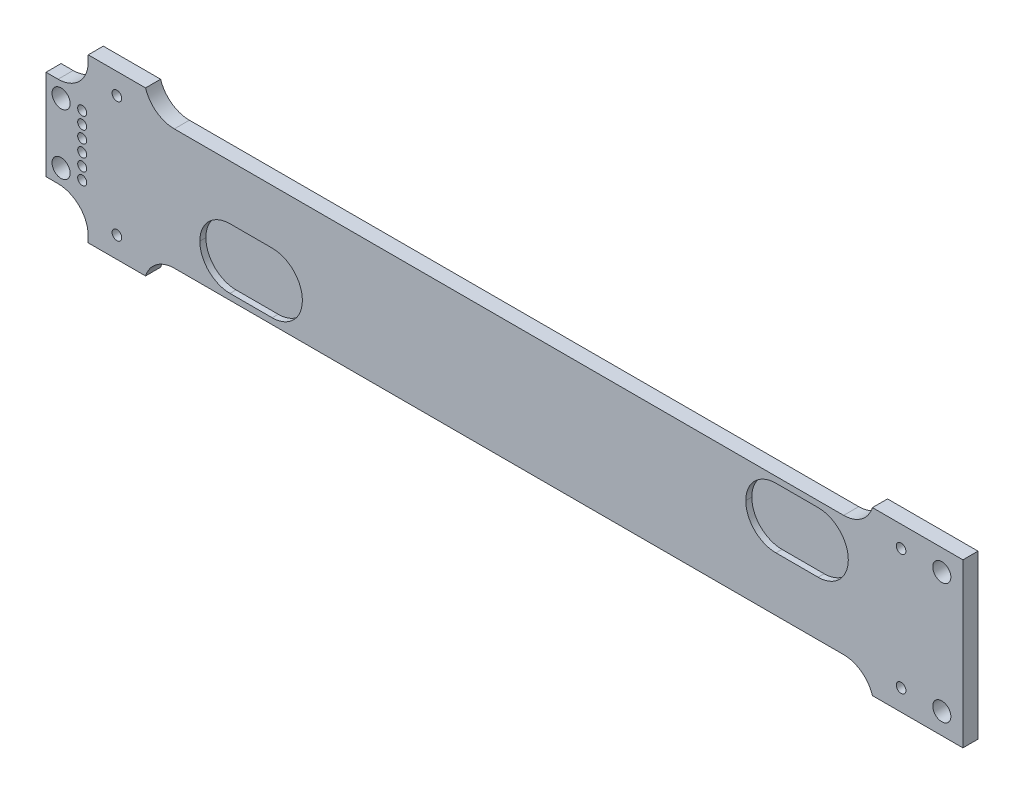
SolidWorks part; units mm, degrees
ref_plane "Спереди" through (0, 0, 0) normal (0, 0, 1) x (1, 0, 0)
ref_plane "Сверху" through (0, 0, 0) normal (0, 1, 0) x (1, 0, 0)
ref_plane "Справа" through (0, 0, 0) normal (1, 0, 0) x (0, 0, -1)
sketch "Эскиз1" plane through (0, 0, 0) normal (0, 0, 1) x (1, 0, 0)
  line L1 (-19.7697, -10) -> (-130.7303, -10)
  line L2 (0, -13.5) -> (0, 13.5) construction
  line L3 (0, 13.5) -> (-15, 13.5)
  line L4 (-130.7303, 10) -> (-19.7697, 10)
  line L6 (-150, 13.5) -> (-150, -13.5)
  line L7 (0, -13.5) -> (-15, -13.5)
  line L8 (-150, -13.5) -> (-135.5, -13.5)
  line L9 (-135.5, 13.5) -> (-150, 13.5)
  line L10 (-150, 13.5) -> (-150, -13.5) construction
  line L11 (0, 13.5) -> (0, -13.5)
  line L12 (0, 0) -> (-143.9085, 0) construction
  arc A0 (-130.7303, 10) -> (-135.5, 13.5) centre (-130.7303, 15) cw
  arc A1 (-19.7697, 10) -> (-15, 13.5) centre (-19.7697, 15) ccw
  arc A2 (-130.7303, -10) -> (-135.5, -13.5) centre (-130.7303, -15) ccw
  arc A3 (-15, -13.5) -> (-19.7697, -10) centre (-19.7697, -15) ccw
  dimension "D6" = 5
  dimension "D1" = 20
  dimension "D2" = 150
  dimension "D3" = 15
  dimension "D4" = 14.5
  dimension "D7" = 27
sheet metal parameters "Листовой металл1" thickness 2.5 parameters "D1"=0.7366
base flange "Базовая кромка1" sketch "Эскиз1" thickness 2.5 reverse thickness direction no parameters "D1"=0.7366
sketch "Эскиз14" plane through (0, 0, -2.5) normal (0, 0, -1) x (-1, 0, 0)
  line L0 (0, 0) -> (-4.6189, 0) construction
  line L1 (17.2321, 8) -> (145.7679, 8)
  line L2 (148.5, -8) -> (148.5, 8) construction
  line L3 (17.2321, -8) -> (145.7679, -8)
  line L4 (148.5, 8) -> (14.5, 8) construction
  line L5 (0, -13.5) -> (0, 13.5) construction
  line L6 (14.5, 5.2679) -> (14.5, -5.2679)
  line L7 (148.5, 5.2679) -> (148.5, -5.2679)
  line L9 (14.5, -8) -> (148.5, -8) construction
  line L10 (14.5, 8) -> (14.5, -8) construction
  line L11 (23.5, 0) -> (192.5911, 0) construction
  arc A0 (17.2321, 8) -> (14.5, 5.2679) centre (15.5, 7) ccw
  arc A1 (14.5, -5.2679) -> (17.2321, -8) centre (15.5, -7) ccw
  arc A2 (145.7679, -8) -> (148.5, -5.2679) centre (147.5, -7) ccw
  arc A3 (148.5, 5.2679) -> (145.7679, 8) centre (147.5, 7) ccw
  dimension "D2" = 1
  dimension "D1" = 4
  dimension "D3" = 1
  dimension "D4" = 1
sketch "Эскиз18" plane through (-150, 0, 0) normal (-1, 0, 0) x (0, 0, 1)
  line L1 (-2.5, 13.5) -> (0, 13.5)
  line L2 (-2.5, 13.5) -> (-2.5, -13.5)
  line L3 (-2.5, -13.5) -> (0, -13.5)
  line L4 (0, 13.5) -> (0, -13.5)
extrude "Бобышка-Вытянуть1" add sketch "Эскиз18" along normal blind 2
sketch "Эскиз19" plane through (0, 0, -2.5) normal (0, 0, -1) x (-1, 0, 0)
  line L0 (152, 0) -> (0, 0) construction
  line L1 (152, 13.5) -> (152, -13.5) construction
  line L2 (0, -13.5) -> (0, 13.5) construction
  line L4 (143, -8) -> (9, -8)
  line L5 (143, -8) -> (143, 8)
  line L6 (143, 8) -> (9, 8)
  line L7 (9, -8) -> (9, 8)
  line L8 (143, -8) -> (9, 8) construction
  line L9 (143, 8) -> (9, -8) construction
  point P6 (76, 0)
  dimension "D1" = 134
  dimension "D2" = 16
extrude "Вырез-Вытянуть1" cut sketch "Эскиз19" against normal blind 1
sketch "Эскиз21" plane through (-9, 0, 0) normal (-1, 0, 0) x (0, 0, 1)
  line L0 (-1.5, 0) -> (-2.5, 0) construction
  line L1 (-1.5, 8) -> (-1.5, -8) construction
  line L2 (-2.5, 8) -> (-2.5, -8) construction
  line L4 (-2.5, -2.5) -> (-1.5, -2.5)
  line L5 (-2.5, -2.5) -> (-2.5, 2.5)
  line L6 (-2.5, 2.5) -> (-1.5, 2.5)
  line L7 (-1.5, -2.5) -> (-1.5, 2.5)
  line L8 (-2.5, -2.5) -> (-1.5, 2.5) construction
  line L9 (-2.5, 2.5) -> (-1.5, -2.5) construction
  point P6 (-2, 0)
  dimension "D1" = 5
extrude "Вырез-Вытянуть7" cut sketch "Эскиз21" against normal through all
sketch "Эскиз22" plane through (0, 0, -2.5) normal (0, 0, -1) x (-1, 0, 0)
  line L0 (76, -8) -> (76, 8) construction
  line L1 (9, -8) -> (143, -8) construction
  line L2 (143, 8) -> (9, 8) construction
  line L3 (142, -6.5) -> (10, 6.5) construction
  circle A0 centre (10, 6.5) radius 2
  circle A1 centre (10, -6.5) radius 2
  circle A2 centre (142, 6.5) radius 2
  circle A3 centre (142, -6.5) radius 2
  point P12 (76, 0)
  point P13 (76, 0)
  dimension "D1" = 4
  dimension "D2" = 132
  dimension "D3" = 4
  dimension "D4" = 13
  dimension "D5" = 13
  dimension "D6" = 132
extrude "Вырез-Вытянуть8" cut sketch "Эскиз22" against normal blind 1
sketch "Эскиз23" plane through (0, 0, 0) normal (0, 0, 1) x (1, 0, 0)
  line L0 (0, -13.5) -> (0, 13.5) construction
  line L1 (-19.7697, 10) -> (-130.7303, 10) construction
  line L2 (-3.5, 0) -> (-7.9257, 0) construction
  line L3 (-3.5, 5) -> (-149.5, 5) construction
  line L4 (-3.5, 5) -> (-3.5, -5) construction
  line L5 (-3.5, -5) -> (-149.5, -5) construction
  line L6 (-149.5, 5) -> (-149.5, -5) construction
  line L7 (-3.5, 5) -> (-149.5, -5) construction
  line L8 (-3.5, -5) -> (-149.5, 5) construction
  line L9 (-3.5, 0) -> (-3.5, 10) construction
  circle A0 centre (-149.5, -5) radius 1.5
  circle A1 centre (-149.5, 5) radius 1.5
  circle A2 centre (-3.5, 10) radius 1.5
  circle A3 centre (-3.5, -10) radius 1.5
  point P5 (-76.5, 0)
  dimension "D3" = 3
  dimension "D4" = 3
  dimension "D5" = 10
  dimension "D6" = 3
  dimension "D1" = 146
  dimension "D2" = 10
  dimension "D7" = 3.5
  dimension "D8" = 5
extrude "Вырез-Вытянуть9" cut sketch "Эскиз23" against normal through all
sketch "Эскиз24" plane through (0, -13.5, 0) normal (0, -1, 0) x (-1, 0, 0)
  line L0 (152, 2.5) -> (135.5, 2.5) construction
  line L1 (152, 0) -> (139, 0)
  line L2 (152, 0) -> (152, 2.5)
  line L3 (152, 2.5) -> (139, 2.5)
  line L4 (139, 0) -> (139, 2.5)
  dimension "D1" = 13
sketch "Эскиз30" plane through (0, 0, -2.5) normal (0, 0, -1) x (-1, 0, 0)
  line L0 (152, 0) -> (146.7263, 0) construction
  line L1 (152, -13.5) -> (146, -13.5)
  line L2 (152, -13.5) -> (152, -7.5)
  line L3 (152, -7.5) -> (146, -7.5)
  line L4 (146, -13.5) -> (146, -7.5)
  line L5 (152, 13.5) -> (152, -13.5) construction
  line L6 (152, 13.5) -> (152, 7.5)
  line L7 (152, 13.5) -> (146, 13.5)
  line L8 (146, 13.5) -> (146, 7.5)
  line L9 (152, 7.5) -> (146, 7.5)
  dimension "D1" = 6
  dimension "D2" = 6
extrude "Вырез-Вытянуть18" cut sketch "Эскиз30" against normal blind 134
fillet "Скругление2" radius 5 2 edges at (-146, 7.5, -1.25) (-146, -7.5, -1.25)
sketch "Эскиз31" plane through (0, 0, -2.5) normal (0, 0, -1) x (-1, 0, 0)
  line L0 (149.5, -3.5) -> (149.5, 3.5) construction
  line L3 (146, 0) -> (146, -5) construction
  circle A0 centre (149.5, -5) radius 1.5 construction
  circle A1 centre (149.5, 5) radius 1.5 construction
  circle A2 centre (146, -5) radius 0.75
  circle A3 centre (146, -3) radius 0.75
  circle A4 centre (146, -1) radius 0.75
  circle A5 centre (146, 1) radius 0.75
  circle A6 centre (146, 3) radius 0.75
  circle A7 centre (146, 5) radius 0.75
  dimension "D2" = 1.5
  dimension "D1" = 5
  dimension "D4" = 3.5
  dimension "D3" = 6
extrude "Вырез-Вытянуть19" cut sketch "Эскиз31" against normal blind 134
sketch "Эскиз32" plane through (0, 0, -2.5) normal (0, 0, -1) x (-1, 0, 0)
  line L0 (146, 13.5) -> (145, 13.5)
  line L1 (135.5, 13.5) -> (146, 13.5) construction
  line L2 (151, 7.5) -> (150, 7.5)
  line L3 (145, 12.5) -> (145, 13.5)
  line L4 (146, 13.5) -> (146, 12.5)
  line L6 (152, 0) -> (148.6345, 0) construction
  line L7 (152, 7.5) -> (152, -7.5) construction
  line L8 (151, -7.5) -> (150, -7.5)
  line L9 (146, -12.5) -> (146, -13.5)
  line L10 (146, -13.5) -> (145, -13.5)
  line L11 (145, -12.5) -> (145, -13.5)
  arc A0 (150, 7.5) -> (145, 12.5) centre (150, 12.5) cw
  arc A1 (146, 12.5) -> (151, 7.5) centre (151, 12.5) ccw
  arc A2 (146, -12.5) -> (151, -7.5) centre (151, -12.5) cw
  arc A3 (150, -7.5) -> (145, -12.5) centre (150, -12.5) ccw
  dimension "D2" = 5
  dimension "D1" = 1
extrude "Вырез-Вытянуть20" cut sketch "Эскиз32" against normal blind 134
sketch "Эскиз33" plane through (0, 0, 0) normal (0, 0, 1) x (1, 0, 0)
  line L0 (-145, -13.5) -> (-135.5, -13.5) construction
  line L2 (0, 13.5) -> (-15, 13.5) construction
  line L3 (-126.5, -9) -> (-109.5, -9)
  line L4 (-126.5, -9) -> (-126.5, 1)
  line L5 (-126.5, 1) -> (-109.5, 1)
  line L6 (-109.5, -9) -> (-109.5, 1)
  line L7 (-126.5, -9) -> (-109.5, 1) construction
  line L8 (-126.5, 1) -> (-109.5, -9) construction
  line L10 (-36, -1) -> (-19, -1)
  line L11 (-36, -1) -> (-36, 9)
  line L12 (-36, 9) -> (-19, 9)
  line L13 (-19, -1) -> (-19, 9)
  line L14 (-36, -1) -> (-19, 9) construction
  line L15 (-36, 9) -> (-19, -1) construction
  circle A0 centre (-149.5, -5) radius 1.5 construction
  dimension "D1" = 4.5
  dimension "D2" = 17
  dimension "D3" = 10
  dimension "D4" = 4.5
  dimension "D5" = 17
  dimension "D6" = 23
extrude "Вырез-Вытянуть21" cut sketch "Эскиз33" against normal blind 1
fillet "Скругление3" radius 5 8 edges at (-36, -1, -0.5) (-19, -1, -0.5) (-36, 9, -0.5) (-19, 9, -0.5) (-126.5, -9, -0.5) (-126.5, 1, -0.5) (-109.5, -9, -0.5) (-109.5, 1, -0.5)
sketch "Эскиз34" plane through (0, 0, 0) normal (0, 0, 1) x (1, 0, 0)
  line L0 (-3.5, 10) -> (-10.25, 10) construction
  line L1 (-3.5, -10) -> (-10.25, -10) construction
  circle A0 centre (-10.25, 10) radius 0.6927
  circle A1 centre (-10.25, -10) radius 0.7613
  dimension "D1" = 6.75
  dimension "D2" = 6.75
extrude "Вырез-Вытянуть22" cut sketch "Эскиз34" against normal blind 10
hole_wizard "Отверстие обработанное метчиком M21" positions "Эскиз35" profile "Эскиз36" tap size "M2" standard "ISO"
sketch "Эскиз35" plane through (0, 0, 0) normal (0, 0, 1) x (1, 0, 0)
  point P0 (-10.25, 10)
  point P3 (-10.25, -10)
sketch "Эскиз36" plane through (-10.25, 10, 0) normal (1, 0, 0) x (0, -1, 0)
  line L0 (0, 0) -> (0, 2.5)
  line L1 (0, 2.5) -> (0.8, 2.5)
  line L2 (0.8, 2.5) -> (0.8, 0)
  line L5 (0.8, 0) -> (0, 0)
  line L11 (0, -6.35) -> (0, 107.95) construction
  dimension "Диаметр проходного сверла" = 1.6
  dimension "Глубина проходного сверла" = 2.5
sketch "Эскиз37" plane through (0, 0, -1.5) normal (0, 0, -1) x (-1, 0, 0)
  line L0 (11.3229, -8) -> (9, -8) construction
  line L1 (9, -4.7679) -> (9, -8) construction
sketch "Эскиз38" plane through (0, 0, -1.5) normal (0, 0, -1) x (-1, 0, 0)
  line L1 (9, -2.5) -> (0, -2.5)
  line L2 (9, -2.5) -> (9, 2.5)
  line L3 (9, 2.5) -> (0, 2.5)
  line L4 (0, -2.5) -> (0, 2.5)
extrude "Бобышка-Вытянуть2" add sketch "Эскиз38" along normal up to surface (1 mm away)
sketch "Эскиз39" plane through (0, 0, 0) normal (0, 0, 1) x (1, 0, 0)
  line L0 (-10.25, 10) -> (-140.25, 10) construction
  line L1 (-152, -7.5) -> (-152, 7.5) construction
  line L2 (-152, 0) -> (-138.1048, 0) construction
  circle A0 centre (-140.25, 10) radius 0.5488
  circle A1 centre (-140.25, -10) radius 0.5488
  dimension "D1" = 11.75
extrude "Вырез-Вытянуть23" cut sketch "Эскиз39" against normal blind 10
hole_wizard "Отверстие обработанное метчиком M22" positions "Эскиз40" profile "Эскиз41" tap size "M2" standard "ISO"
sketch "Эскиз40" plane through (0, 0, 0) normal (0, 0, 1) x (1, 0, 0)
  point P0 (-140.25, 10)
  point P3 (-140.25, -10)
sketch "Эскиз41" plane through (-140.25, 10, 0) normal (1, 0, 0) x (0, -1, 0)
  line L0 (0, 0) -> (0, 6.4807)
  line L1 (0, 6.4807) -> (0.8, 6)
  line L2 (0.8, 6) -> (0.8, 0)
  line L5 (0.8, 0) -> (0, 0)
  line L10 (0, 6.4807) -> (-0.8, 6) construction
  line L11 (0, -6.35) -> (0, 107.95) construction
  dimension "Диаметр сверла" = 1.6
  dimension "Глубина сверла" = 6
  dimension "Угол заточки сверла" = 118
sketch "Эскиз43" plane through (0, 0, 0) normal (0, 0, 1) x (1, 0, 0)
  line L0 (-118, 1) -> (-118, -9) construction
  line L1 (-114.5, 1) -> (-121.5, 1) construction
  line L2 (-121.5, -9) -> (-114.5, -9) construction
  line L3 (-27.5, 9) -> (-27.5, -1) construction
  line L4 (-24, 9) -> (-31, 9) construction
  line L5 (-31, -1) -> (-24, -1) construction
chamfer "Фаска1" distance 0.7 angle 45 1 edges at (-143, 0, -2.5)
flat pattern "Развертка1"
sketch "Сгиб-Линии1" plane through (0, 0, 0) normal (0, 1, 0) x (1, 0, 0)
sketch3d "Граничная рамка1" [suppressed]
  line L0 (-21.2697, 1.5, 0) -> (130.7303, 1.5, 0) construction
  line L1 (-21.2697, 28.5, 0) -> (130.7303, 28.5, 0) construction
  line L2 (-21.2697, 1.5, 0) -> (-21.2697, 28.5, 0) construction
  line L3 (130.7303, 1.5, 0) -> (130.7303, 28.5, 0) construction
sketch "Эскиз14-1" [suppressed] plane through (0, 0, -2.5) normal (0, 0, -1) x (-1, 0, 0)
  line L0 (0, 0) -> (-4.6189, 0) construction
  line L1 (17.2321, 8) -> (145.7679, 8)
  line L3 (17.2321, -8) -> (145.7679, -8)
  line L6 (14.5, 5.2679) -> (14.5, -5.2679)
  line L7 (148.5, 5.2679) -> (148.5, -5.2679)
  line L11 (23.5, 0) -> (192.5911, 0) construction
  arc A0 (17.2321, 8) -> (14.5, 5.2679) centre (15.5, 7) ccw
  arc A1 (14.5, -5.2679) -> (17.2321, -8) centre (15.5, -7) ccw
  arc A2 (145.7679, -8) -> (148.5, -5.2679) centre (147.5, -7) ccw
  arc A3 (148.5, 5.2679) -> (145.7679, 8) centre (147.5, 7) ccw
  dimension "D2" = 1
  dimension "D1" = 4
  dimension "D3" = 1
  dimension "D4" = 1
sketch "Эскиз17-1" [suppressed] plane through (0, 0, -2.5) normal (0, 0, -1) x (-1, 0, 0)
  line L0 (0, 0) -> (14.5, 0) construction
  line L4 (14.5, -2.5) -> (0, -2.5)
  line L5 (14.5, -2.5) -> (14.5, 2.5)
  line L6 (14.5, 2.5) -> (0, 2.5)
  line L7 (0, -2.5) -> (0, 2.5)
  line L8 (14.5, -2.5) -> (0, 2.5) construction
  line L9 (14.5, 2.5) -> (0, -2.5) construction
  point P6 (7.25, 0)
  dimension "D1" = 5
sketch "Эскиз14-2" [suppressed] plane through (0, 0, -2.5) normal (0, 0, -1) x (-1, 0, 0)
  line L0 (0, 0) -> (-4.6189, 0) construction
  line L1 (17.2321, 8) -> (145.7679, 8)
  line L3 (17.2321, -8) -> (145.7679, -8)
  line L6 (14.5, 5.2679) -> (14.5, -5.2679)
  line L7 (148.5, 5.2679) -> (148.5, -5.2679)
  line L11 (23.5, 0) -> (192.5911, 0) construction
  arc A0 (17.2321, 8) -> (14.5, 5.2679) centre (15.5, 7) ccw
  arc A1 (14.5, -5.2679) -> (17.2321, -8) centre (15.5, -7) ccw
  arc A2 (145.7679, -8) -> (148.5, -5.2679) centre (147.5, -7) ccw
  arc A3 (148.5, 5.2679) -> (145.7679, 8) centre (147.5, 7) ccw
  dimension "D2" = 1
  dimension "D1" = 4
  dimension "D3" = 1
  dimension "D4" = 1
sketch "Эскиз17-2" [suppressed] plane through (0, 0, -2.5) normal (0, 0, -1) x (-1, 0, 0)
  line L0 (0, 0) -> (14.5, 0) construction
  line L4 (14.5, -2.5) -> (0, -2.5)
  line L5 (14.5, -2.5) -> (14.5, 2.5)
  line L6 (14.5, 2.5) -> (0, 2.5)
  line L7 (0, -2.5) -> (0, 2.5)
  line L8 (14.5, -2.5) -> (0, 2.5) construction
  line L9 (14.5, 2.5) -> (0, -2.5) construction
  point P6 (7.25, 0)
  dimension "D1" = 5
